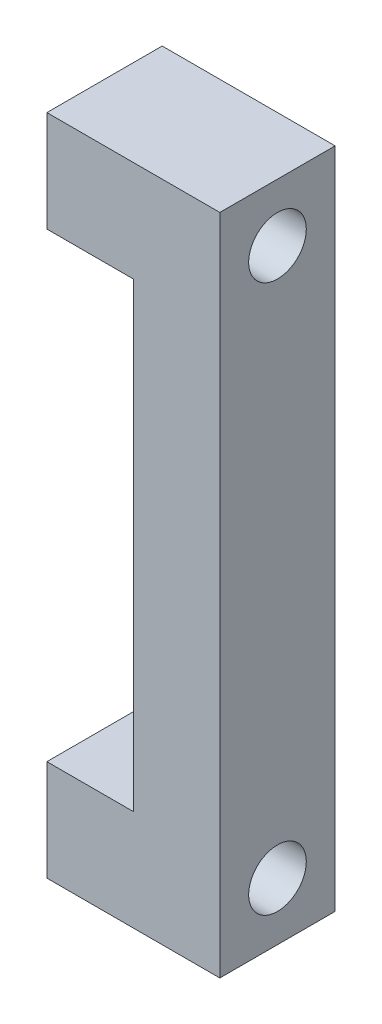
SolidWorks part; units mm, degrees
ref_plane "Front Plane" through (0, 0, 0) normal (0, 0, 1) x (1, 0, 0)
ref_plane "Top Plane" through (0, 0, 0) normal (0, 1, 0) x (1, 0, 0)
ref_plane "Right Plane" through (0, 0, 0) normal (1, 0, 0) x (0, 0, -1)
sketch "Sketch4" plane through (0, 0, 0) normal (0, 0, 1) x (1, 0, 0)
  line L0 (0, 0) -> (0, 36.5125)
  line L1 (0, 36.5125) -> (-19.05, 36.5125)
  line L2 (-19.05, 36.5125) -> (-19.05, 25.4)
  line L3 (-19.05, 25.4) -> (-9.525, 25.4)
  line L4 (-9.525, 25.4) -> (-9.525, -25.4)
  line L5 (-9.525, -25.4) -> (-19.05, -25.4)
  line L6 (-19.05, -25.4) -> (-19.05, -36.5125)
  line L7 (-19.05, -36.5125) -> (0, -36.5125)
  line L8 (0, -36.5125) -> (0, 0)
  line L9 (-19.05, 30.1625) -> (0, 30.1625)
  line L10 (-19.05, -30.1625) -> (0, -30.1625)
  line L11 (0, 0) -> (17.2237, 0) construction
  dimension "D1" = 50.8
  dimension "D2" = 73.025
  dimension "D3" = 19.05
  dimension "D4" = 9.525
  dimension "D5" = 60.325
  dimension "D6" = 6.35
  dimension "D7" = 11.1125
sketch "Sketch5" plane through (0, 0, 0) normal (0, 0, 1) x (1, 0, 0)
  line L0 (-19.05, -36.5125) -> (0, -36.5125) construction
  line L1 (0, -36.5125) -> (0, 0) construction
  line L2 (0, 0) -> (0, 36.5125) construction
  line L3 (0, 36.5125) -> (-19.05, 36.5125) construction
  line L4 (-19.05, 36.5125) -> (-19.05, 25.4) construction
  line L5 (-19.05, 25.4) -> (-9.525, 25.4) construction
  line L6 (-9.525, 25.4) -> (-9.525, -25.4) construction
  line L7 (-9.525, -25.4) -> (-19.05, -25.4) construction
  line L8 (-19.05, -25.4) -> (-19.05, -36.5125) construction
  line L9 (-19.05, -36.5125) -> (0, -36.5125)
  line L10 (0, -36.5125) -> (0, 0)
  line L11 (0, 0) -> (0, 36.5125)
  line L12 (0, 36.5125) -> (-19.05, 36.5125)
  line L13 (-19.05, 36.5125) -> (-19.05, 25.4)
  line L14 (-19.05, 25.4) -> (-9.525, 25.4)
  line L15 (-9.525, 25.4) -> (-9.525, -25.4)
  line L16 (-9.525, -25.4) -> (-19.05, -25.4)
  line L17 (-19.05, -25.4) -> (-19.05, -36.5125)
extrude "Boss-Extrude2" add sketch "Sketch5" along normal mid plane 12.7
sketch "Sketch6" plane through (0, 0, 0) normal (1, 0, 0) x (0, 0, -1)
  circle A0 centre (0, 30.1625) radius 3.175
  circle A1 centre (0, -30.1625) radius 3.175
  circle A2 centre (0, 30.1625) radius 4.7625
  circle A3 centre (0, -30.1625) radius 4.7625
  dimension "D1" = 6.35
  dimension "D2" = 9.525
sketch "Sketch7" plane through (0, 0, 0) normal (1, 0, 0) x (0, 0, -1)
  circle A0 centre (0, 30.1625) radius 3.175 construction
  circle A1 centre (0, -30.1625) radius 3.175 construction
  circle A2 centre (0, 30.1625) radius 3.175
  circle A3 centre (0, -30.1625) radius 3.175
extrude "Cut-Extrude3" cut sketch "Sketch7" against normal blind 25.4
sketch "Sketch8" plane through (0, 0, 0) normal (1, 0, 0) x (0, 0, -1)
  circle A0 centre (0, 30.1625) radius 4.7625 construction
  circle A1 centre (0, -30.1625) radius 4.7625 construction
  circle A2 centre (0, 30.1625) radius 4.7625
  circle A3 centre (0, -30.1625) radius 4.7625
extrude "Cut-Extrude4" [suppressed] cut sketch "Sketch8" against normal blind 4.7752
